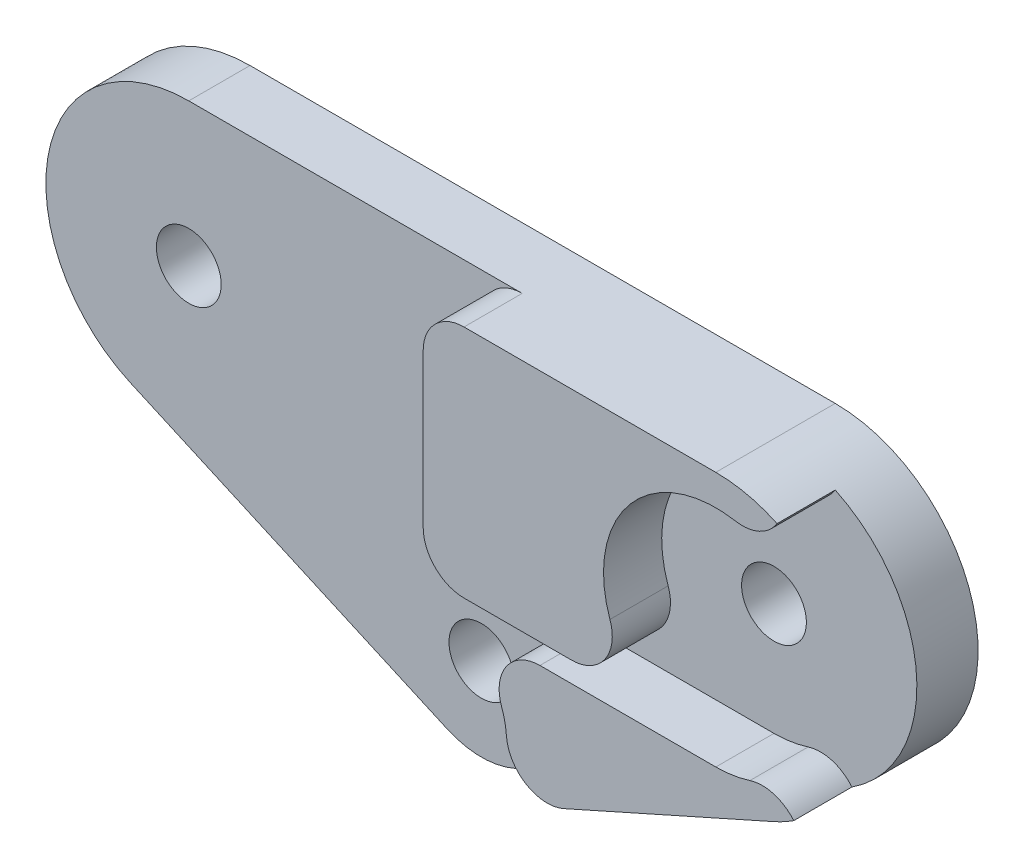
SolidWorks part; units mm, degrees
ref_plane "Front Plane" through (0, 0, 0) normal (0, 0, 1) x (1, 0, 0)
ref_plane "Top Plane" through (0, 0, 0) normal (0, 1, 0) x (1, 0, 0)
ref_plane "Right Plane" through (0, 0, 0) normal (1, 0, 0) x (0, 0, -1)
sketch "Sketch1" plane through (0, 0, 0) normal (0, 0, 1) x (1, 0, 0)
  line L0 (0, 0) -> (0, -9.5875) construction
  line L1 (0, 0) -> (-14.3333, 0) construction
  line L2 (-14.3333, -5.5) -> (14.3333, -5.5) construction
  line L3 (-17.1866, -6.3921) -> (-1.6661, -13.32)
  line L4 (17.1866, -6.3921) -> (1.6661, -13.32)
  line L5 (-14.3333, 7) -> (14.3333, 7)
  circle A0 centre (-14.3333, 0) radius 5.5 construction
  circle A1 centre (14.3333, 0) radius 5.5 construction
  circle A2 centre (0, -9.5875) radius 4.0875 construction
  arc A3 (-14.3333, 7) -> (-17.1866, -6.3921) centre (-14.3333, 0) ccw
  arc A4 (-1.6661, -13.32) -> (1.6661, -13.32) centre (0, -9.5875) ccw
  arc A5 (14.3333, 7) -> (17.1866, -6.3921) centre (14.3333, 0) cw
  dimension "D1" = 11
  dimension "D2" = 28.6667
  dimension "D3" = 8.175
  dimension "D4" = 1.5
extrude "Plate Body" add sketch "Sketch1" along normal blind 3
sketch "Sketch2" plane through (0, 0, 3) normal (0, 0, 1) x (1, 0, 0)
  circle A0 centre (-14.3333, 0) radius 1.5875
  circle A1 centre (14.3333, 0) radius 1.5875
  circle A2 centre (0, -9.5875) radius 1.5875
  dimension "D1" = 3.175
extrude "Pulley Pins" cut sketch "Sketch2" against normal through all
sketch "Sketch3" plane through (0, 0, 3) normal (0, 0, 1) x (1, 0, 0)
  line L0 (0, 7) -> (14.3333, 7)
  line L1 (14.3333, 0) -> (17.3333, 6.3246) construction
  line L2 (0, 7) -> (0, -4.5)
  line L3 (14.3333, 7) -> (-14.3333, 7) construction
  line L4 (0, -4.5) -> (11.1711, -4.5)
  line L5 (-14.3333, -5.5) -> (14.3333, -5.5) construction
  line L6 (0, -5.5) -> (14.3333, -5.5)
  line L7 (16.6905, 4.9693) -> (17.3333, 6.3246)
  line L8 (14.3333, 0) -> (17.3333, -4.6098) construction
  line L9 (17.3333, -4.6098) -> (17.3333, 6.3246) construction
  line L10 (17.3333, -4.6098) -> (18.1515, -5.867)
  line L12 (4.0875, -9.5875) -> (4.0875, -12.2392)
  line L13 (1.6661, -13.32) -> (17.1866, -6.3921) construction
  line L14 (4.0875, -12.2392) -> (17.1866, -6.3921)
  circle A0 centre (-14.3333, 0) radius 5.5 construction
  circle A1 centre (14.3333, 0) radius 5.5 construction
  arc A2 (-14.3333, 7) -> (-17.1866, -6.3921) centre (-14.3333, 0) ccw construction
  circle A3 centre (0, -9.5875) radius 4.0875 construction
  arc A4 (-1.6661, -13.32) -> (1.6661, -13.32) centre (0, -9.5875) ccw construction
  arc A5 (17.1866, -6.3921) -> (14.3333, 7) centre (14.3333, 0) ccw construction
  arc A6 (14.3333, 7) -> (17.3333, 6.3246) centre (14.3333, 0) cw
  arc A7 (16.6905, 4.9693) -> (11.1711, -4.5) centre (14.3333, 0) ccw
  arc A8 (14.3333, -5.5) -> (17.3333, -4.6098) centre (14.3333, 0) ccw
  arc A9 (17.1866, -6.3921) -> (18.1515, -5.867) centre (14.3333, 0) ccw
  arc A10 (17.3333, 6.3246) -> (14.3333, 7) centre (14.3333, 0) ccw
  arc A11 (0, -5.5) -> (4.0875, -9.5875) centre (0, -9.5875) cw
  dimension "D1" = 1.5
  dimension "D2" = 3
  dimension "D3" = 1
extrude "Flanges" add sketch "Sketch3" along normal blind 2.85 contours A7 L7 L2 L4 M11 M12 | L6 A11 L12 L10 A8 M10 M11
fillet "Contouring" radius 2 8 edges at (11.1711, -4.5, 4.425) (4.0875, -12.2392, 4.425) (4.0875, -9.5875, 4.425) (0, -5.5, 4.425) (0, -4.5, 4.425) (17.3333, -4.6098, 4.425) (16.6905, 4.9693, 4.425)
ref_point "Ref Center"
equation "\"D1@Sketch1\"=\"pulley diameter@values@params.sldprt\"+1.5"
equation "\"D3@Sketch1\"=\"pin diameter@values@params.sldprt\"+5"
equation "\"D1@Plate Body\"=\"width keep@values@params.sldprt\""
equation "\"D1@Sketch2\"=\"pin diameter@values@params.sldprt\""
equation "\"D1@Flanges\"=\"pulley thickness@values@params.sldprt\"+\"print free@values@params.sldprt\""
